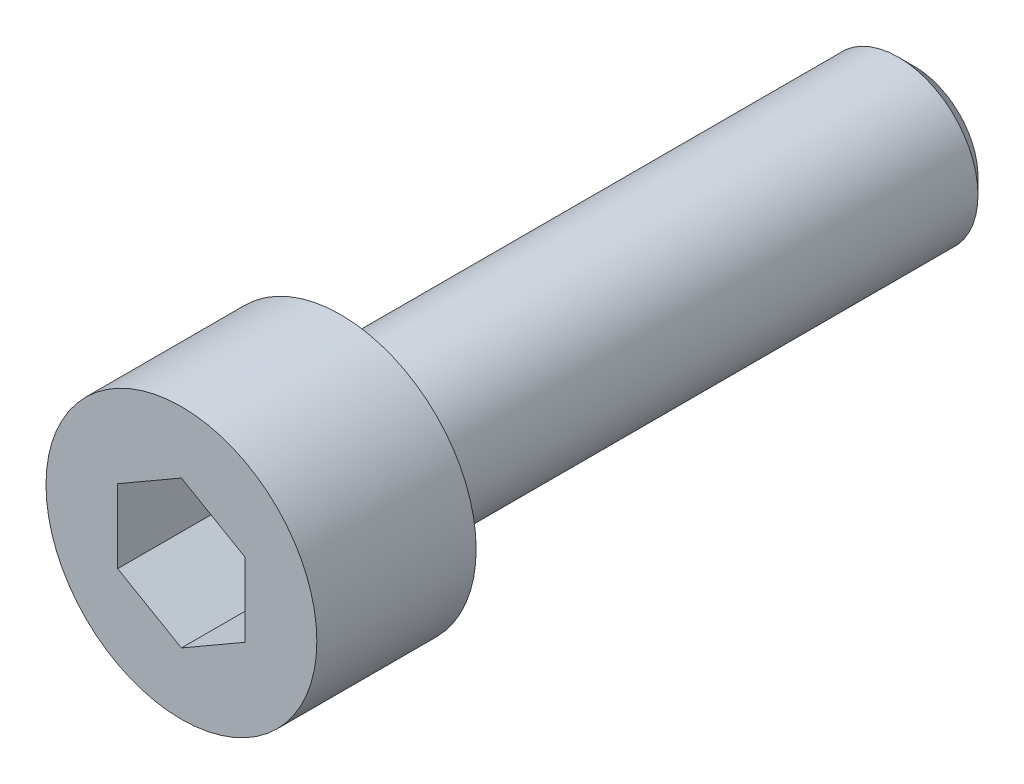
SolidWorks part; units mm, degrees
ref_plane "Front" through (0, 0, 0) normal (0, 0, 1) x (1, 0, 0)
ref_plane "Top" through (0, 0, 0) normal (0, 1, 0) x (1, 0, 0)
ref_plane "Right" through (0, 0, 0) normal (1, 0, 0) x (0, 0, -1)
sketch "Sketch1" plane through (0, 0, 0) normal (0, 0, 1) x (1, 0, 0)
  circle A0 centre (0, 0) radius 4.25
  dimension "D1" = 8.5
extrude "Base-Extrude" add sketch "Sketch1" against normal blind 5
sketch "Sketch2" plane through (0, 0, -5) normal (0, 0, -1) x (-1, 0, 0)
  circle A0 centre (0, 0) radius 2.5
  circle A1 centre (0, 0) radius 4.25 construction
  dimension "D1" = 5
extrude "Boss-Extrude1" add sketch "Sketch2" along normal blind 18
sketch "Sketch3" plane through (0, 0, 0) normal (0, 0, 1) x (1, 0, 0)
  line L0 (0, -50) -> (0, 50) construction
  line L1 (2, -1.1547) -> (2, 1.1547)
  line L2 (2, 1.1547) -> (0, 2.3094)
  line L3 (0, 2.3094) -> (-2, 1.1547)
  line L4 (-2, 1.1547) -> (-2, -1.1547)
  line L5 (-2, -1.1547) -> (0, -2.3094)
  line L6 (0, -2.3094) -> (2, -1.1547)
  circle A0 centre (0, 0) radius 2 construction
  dimension "D1" = 4
extrude "Cut-Extrude1" cut sketch "Sketch3" against normal blind 5
chamfer "Chamfer1" distance 0.5 angle 45 1 edges at (-2.5, 0, -23)
